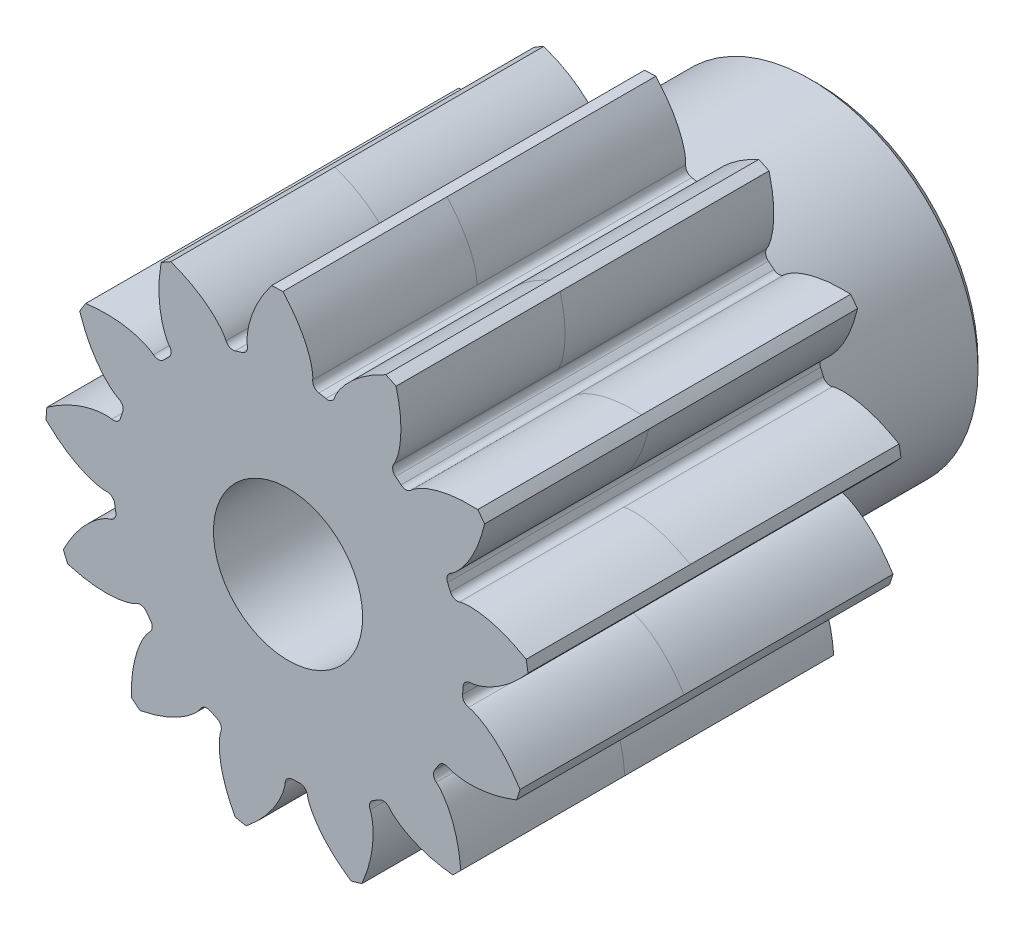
SolidWorks part; units mm, degrees
ref_plane "Face" through (0, 0, 0) normal (0, 0, 1) x (1, 0, 0)
ref_plane "Dessus" through (0, 0, 0) normal (0, 1, 0) x (1, 0, 0)
ref_plane "Droite" through (0, 0, 0) normal (1, 0, 0) x (0, 0, -1)
imported_body "Importée1"
sketch "Esquisse1" plane through (0, 0, 5) normal (0, 0, 1) x (1, 0, 0)
  circle A0 centre (0, 0) radius 2.7085
  dimension "D1" = 5.417
surface "Surface-primitive" sketch "Esquisse1"
